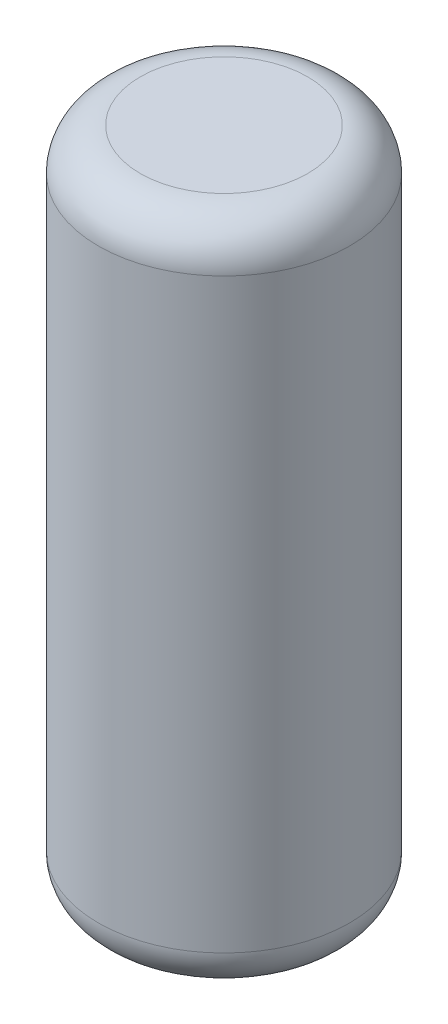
SolidWorks part; units mm, degrees
ref_plane "Front Plane" through (0, 0, 0) normal (0, 0, 1) x (1, 0, 0)
ref_plane "Top Plane" through (0, 0, 0) normal (0, 1, 0) x (1, 0, 0)
ref_plane "Right Plane" through (0, 0, 0) normal (1, 0, 0) x (0, 0, -1)
sketch "Sketch1" plane through (0, 0, 0) normal (0, 1, 0) x (1, 0, 0)
  circle A0 centre (0, 0) radius 1.5
  dimension "D1" = 3
extrude "Boss-Extrude1" add sketch "Sketch1" along normal blind 8
fillet "Fillet1" radius 0.5 2 edges at (0, 0, 1.5) (0, 8, 1.5)
